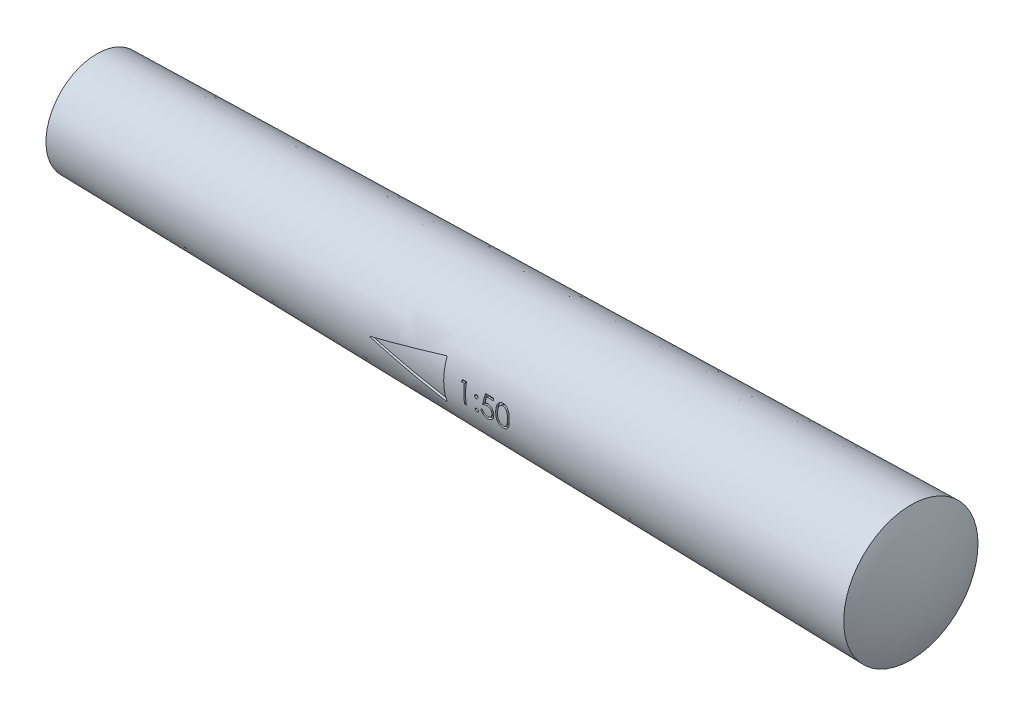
SolidWorks part; units mm, degrees
ref_plane "Front Plane" through (0, 0, 0) normal (0, 0, 1) x (1, 0, 0)
ref_plane "Top Plane" through (0, 0, 0) normal (0, 1, 0) x (1, 0, 0)
ref_plane "Right Plane" through (0, 0, 0) normal (1, 0, 0) x (0, 0, -1)
sketch "Sketch1" plane through (0, 0, 0) normal (1, 0, 0) x (0, 0, -1)
  circle A0 centre (0, 0) radius 2.5
  dimension "D1" = 5
extrude "Extrude1" add sketch "Sketch1" along normal mid plane 40
draft "Draft1" type of draft neutral plane draft angle 1.146 faces to draft 1 parameters "D1"=1.146
sketch "Sketch2" plane through (0, 0, 0) normal (0, 0, 1) x (1, 0, 0)
  line L0 (-20, 0) -> (-20, 2.5)
  line L1 (-20, 2.5) -> (-20, -2.5) construction
  line L2 (-20, 0) -> (-20.75, 0)
  line L3 (-20.75, 0) -> (-20.75, -2.9) construction
  line L4 (20, 0) -> (20, 3.3)
  line L5 (20, -3.3) -> (20, 3.3) construction
  line L6 (20, 0) -> (20.75, 0)
  line L7 (20.75, 0) -> (20.75, -2.9) construction
  line L8 (-20, -2.5) -> (20, -3.3) construction
  arc A0 (-20.75, 0) -> (-20, 2.5) centre (-16.2083, 0) cw
  arc A1 (20.75, 0) -> (20, 3.3) centre (13.1149, 0) ccw
  point P14 (0, -2.9)
revolve "Revolve1" add sketch "Sketch2" angle 360 about L2
sketch "Sketch5" plane through (0, 0, 0) normal (0, 0, 1) x (1, 0, 0)
  line L0 (0, 2.9) -> (0, -2.9) construction
  line L1 (20, 3.3) -> (-20, 2.5) construction
  line L2 (-20, -2.5) -> (20, -3.3) construction
ref_plane "Plane2" through (0, 0, 0) normal (-0.02, 0, 0.9998) x (0.9998, 0, 0.02)
sketch "Sketch6" plane through (0, 0, 0) normal (-0.02, 0, 0.9998) x (0.9998, 0, 0.02)
  line L0 (0, 0) -> (0, 1)
  line L1 (0, 2.9) -> (0, -2.9) construction
  line L2 (0, 1) -> (-3.7321, 0)
  line L3 (-3.7321, 0) -> (0, -1)
  line L4 (0, -1) -> (0, 0)
  line L5 (0, -0.5) -> (4, -0.5) construction
  text T0 "1:50" font "Century Gothic" height 1
  dimension "D1" = 2
  dimension "D2" = 30
  dimension "D3" = 4
wrap "Wrap2" sketch "Sketch6" wrap type deboss source sketch "Sketch6" thickness 0.1 parameters "D1"=0.1
equation "\"D2@Sketch2\" = \"D1@Sketch2\""
